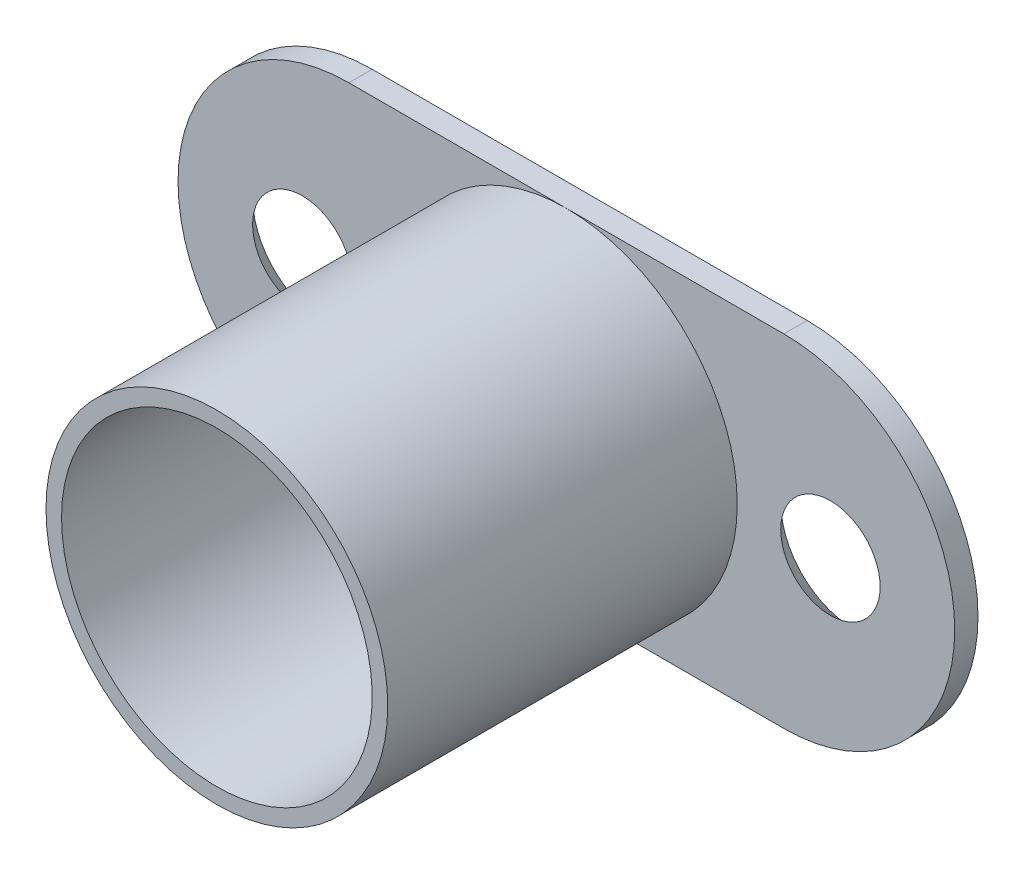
SolidWorks part; units mm, degrees
ref_plane "Face" through (0, 0, 0) normal (0, 0, 1) x (1, 0, 0)
ref_plane "Dessus" through (0, 0, 0) normal (0, 1, 0) x (1, 0, 0)
ref_plane "Droite" through (0, 0, 0) normal (1, 0, 0) x (0, 0, -1)
sketch "Esquisse1" plane through (0, 0, 0) normal (0, 0, 1) x (1, 0, 0)
  line L0 (0, 11) -> (28, 11)
  line L1 (0, -11) -> (28, -11)
  arc A0 (0, 11) -> (0, -11) centre (0, 0) ccw
  arc A1 (28, -11) -> (28, 11) centre (28, 0) ccw
  dimension "D1" = 22
  dimension "D2" = 22
  dimension "D3" = 28
extrude "Base-Extrusion" add sketch "Esquisse1" against normal blind 1.5
sketch "Esquisse2" plane through (0, 0, 0) normal (0, 0, 1) x (1, 0, 0)
  line L1 (0, -11) -> (28, -11) construction
  circle A0 centre (14, 0) radius 11
  dimension "D1" = 22
  dimension "D2" = 11
  dimension "D3" = 14
extrude "Boss.-Extru.-Mince1" add sketch "Esquisse2" along normal blind 22.5 thin
sketch "Esquisse3" plane through (0, 0, 0) normal (0, 0, 1) x (1, 0, 0)
  circle A0 centre (14, 0) radius 3.6
  circle A1 centre (14, 0) radius 10 construction
  dimension "D1" = 7.2
extrude "Enlèv. mat.-Extru.1" cut sketch "Esquisse3" against normal through all
hole_wizard "Fraisage pour vis à tête fraisée M41" positions "Esquisse6" profile "Esquisse5" countersink size "M4" standard "Ansi Métrique"
sketch "Esquisse6" plane through (0, 0, -1.5) normal (0, 0, -1) x (-1, 0, 0)
  circle A1 centre (-14, 0) radius 3.6 construction
  point P0 (3, 0)
  dimension "D1" = 17
sketch "Esquisse5" plane through (-3, 0, -1.5) normal (1, 0, 0) x (0, 1, 0)
  line L0 (0, 0) -> (0, 24)
  line L1 (0, 24) -> (2.25, 24)
  line L2 (2.25, 24) -> (2.25, 2.45)
  line L3 (2.25, 2.45) -> (4.7, 0)
  line L5 (4.7, 0) -> (0, 0)
  line L6 (-2.25, 2.45) -> (-4.7, 0) construction
  line L11 (0, -6.35) -> (0, 107.95) construction
  dimension "Diamètre du perçage jusqu'au prochain" = 4.5
  dimension "Profondeur du perçage jusqu'au prochain" = 24
  dimension "Diamètre du fraisage entrant" = 9.4
  dimension "Angle du fraisage entrant" = 90
hole_wizard "Fraisage pour vis à tête fraisée M42" positions "Esquisse8" profile "Esquisse7" countersink size "M4" standard "Ansi Métrique"
sketch "Esquisse8" plane through (0, 0, -1.5) normal (0, 0, -1) x (-1, 0, 0)
  circle A1 centre (-14, 0) radius 3.6 construction
  point P0 (-31, 0)
  dimension "D1" = 17
sketch "Esquisse7" plane through (31, 0, -1.5) normal (1, 0, 0) x (0, 1, 0)
  line L0 (0, 0) -> (0, 24)
  line L1 (0, 24) -> (2.25, 24)
  line L2 (2.25, 24) -> (2.25, 2.45)
  line L3 (2.25, 2.45) -> (4.7, 0)
  line L5 (4.7, 0) -> (0, 0)
  line L6 (-2.25, 2.45) -> (-4.7, 0) construction
  line L11 (0, -6.35) -> (0, 107.95) construction
  dimension "Diamètre du perçage jusqu'au prochain" = 4.5
  dimension "Profondeur du perçage jusqu'au prochain" = 24
  dimension "Diamètre du fraisage entrant" = 9.4
  dimension "Angle du fraisage entrant" = 90
